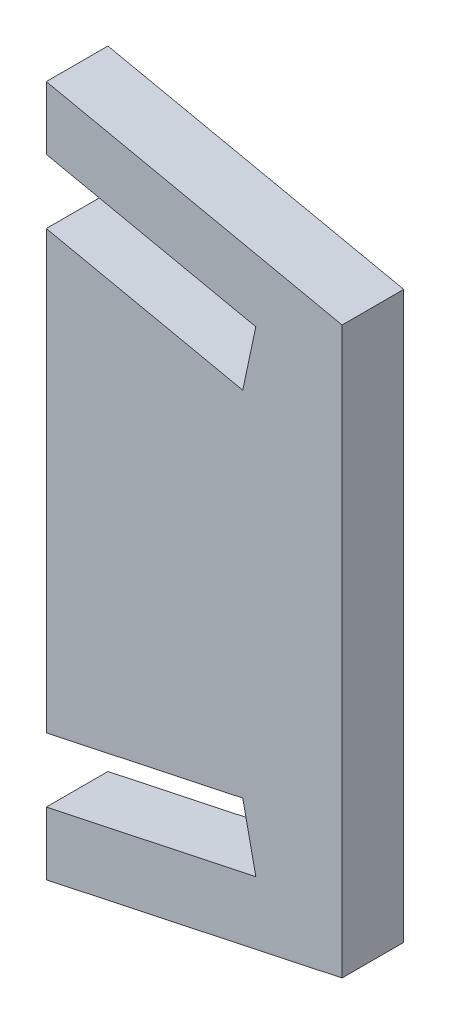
SolidWorks part; units mm, degrees
ref_plane "Plan de face" through (0, 0, 0) normal (0, 0, 1) x (1, 0, 0)
ref_plane "Plan de dessus" through (0, 0, 0) normal (0, 1, 0) x (1, 0, 0)
ref_plane "Plan de droite" through (0, 0, 0) normal (1, 0, 0) x (0, 0, -1)
sketch "Esquisse1" plane through (0, 0, 0) normal (0, 0, 1) x (1, 0, 0)
  line L1 (0, 0) -> (-48, 0)
  line L2 (0, 0) -> (0, 130)
  line L3 (0, 130) -> (-48, 130)
  line L4 (-48, 0) -> (-48, 130)
  dimension "D1" = 130
  dimension "D2" = 48
extrude "Boss.-Extru.1" add sketch "Esquisse1" along normal blind 10
sketch "Esquisse2" plane through (0, 0, 10) normal (0, 0, 1) x (1, 0, 0)
  line L5 (-48, 110.864) -> (-14, 103.6371)
  line L6 (-48, 130) -> (-48, 0) construction
  line L7 (-14, 103.6371) -> (-16.1207, 93.66)
  line L8 (-16.1207, 93.66) -> (-48, 100.4362)
  line L9 (-48, 100.4362) -> (-48, 110.864)
  line L10 (0, 130) -> (-48, 130) construction
  line L11 (0, 0) -> (0, 130) construction
  line L12 (-48, 65) -> (8.5132, 65) construction
  line L13 (-48, 29.5638) -> (-48, 19.136)
  line L14 (-16.1207, 36.34) -> (-48, 29.5638)
  line L15 (-14, 26.3629) -> (-16.1207, 36.34)
  line L16 (-48, 19.136) -> (-14, 26.3629)
  point P12 (0, 0)
  dimension "D1" = 10.2
  dimension "D2" = 12
  dimension "D3" = 14
  dimension "D4" = 28.66
extrude "Enlèv. mat.-Extru.1" cut sketch "Esquisse2" against normal blind 10
sketch "Esquisse3" plane through (0, 0, 10) normal (0, 0, 1) x (1, 0, 0)
  line L0 (-89.9303, 130) -> (0, 110.8847)
  line L1 (0, 130) -> (-48, 130) construction
  line L2 (0, 0) -> (0, 130) construction
  line L3 (0, 110.8847) -> (0, 130)
  line L4 (0, 130) -> (-89.9303, 130)
  line L5 (-48, 65) -> (6.884, 65) construction
  line L6 (-48, 100.4362) -> (-48, 29.5638) construction
  line L7 (0, 0) -> (-89.9303, 0)
  line L8 (0, 19.1153) -> (0, 0)
  line L9 (-89.9303, 0) -> (0, 19.1153)
  line L11 (-14, 103.6371) -> (-48, 110.864) construction
  dimension "D1" = 10
extrude "Enlèv. mat.-Extru.2" cut sketch "Esquisse3" against normal blind 10
